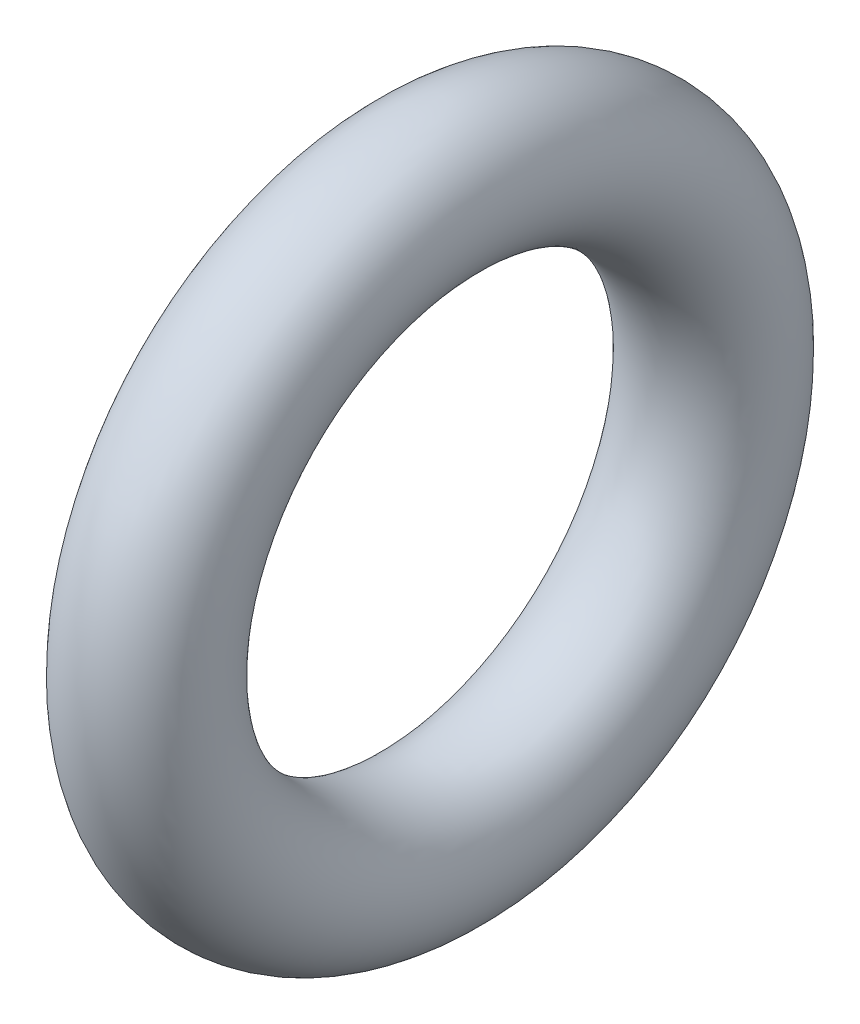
SolidWorks part; units mm, degrees
ref_plane "Front Plane" through (0, 0, 0) normal (0, 0, 1) x (1, 0, 0)
ref_plane "Top Plane" through (0, 0, 0) normal (0, 1, 0) x (1, 0, 0)
ref_plane "Right Plane" through (0, 0, 0) normal (1, 0, 0) x (0, 0, -1)
sketch "Sketch1" plane through (0, 0, 0) normal (0, 0, 1) x (1, 0, 0)
  line L0 (0, 0) -> (5.08, 0) construction
  line L1 (0, 0) -> (0, 3.175) construction
  circle A1 centre (0, 3.175) radius 0.7937
revolve "Revolve3" add sketch "Sketch1" angle 360 about L0
